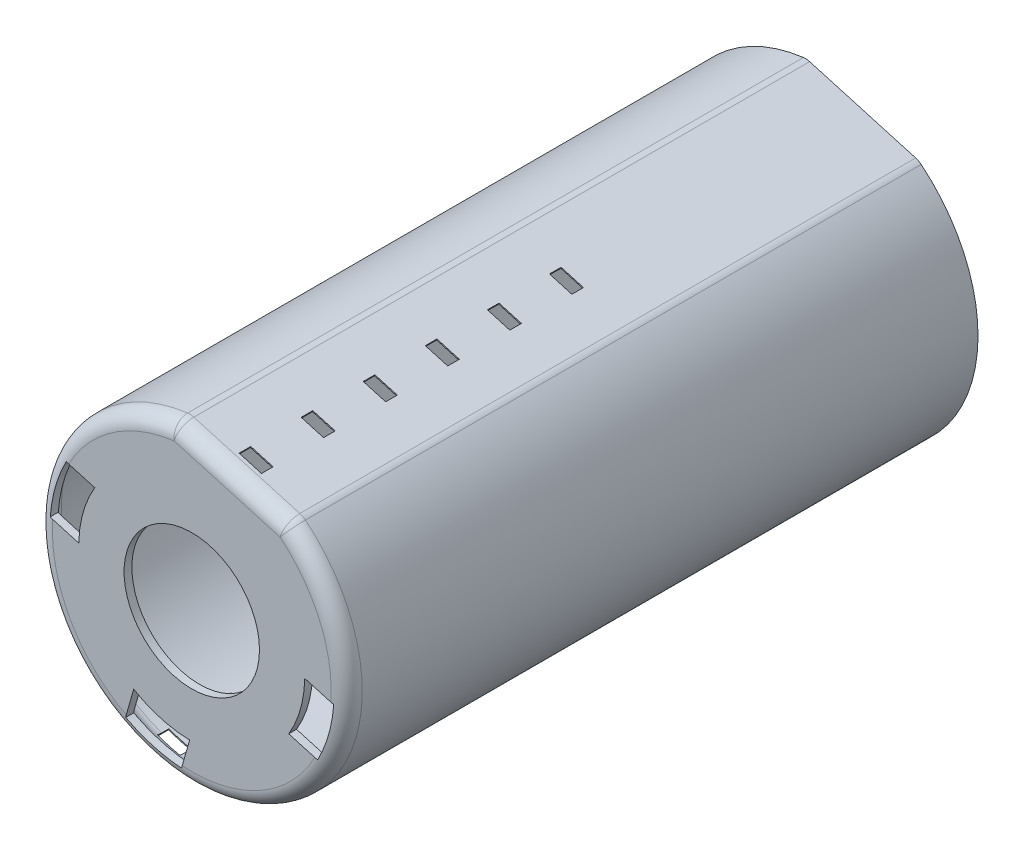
SolidWorks part; units mm, degrees
ref_plane "Front Plane" through (0, 0, 0) normal (0, 0, 1) x (1, 0, 0)
ref_plane "Top Plane" through (0, 0, 0) normal (0, 1, 0) x (1, 0, 0)
ref_plane "Right Plane" through (0, 0, 0) normal (1, 0, 0) x (0, 0, -1)
sketch "Sketch1" plane through (0, 0, 0) normal (0, 0, 1) x (1, 0, 0)
  circle A0 centre (0, 0) radius 174.5
  circle A1 centre (0, 0) radius 399.3
  dimension "D1" = 349
  dimension "D2" = 798.6
extrude "Extrude1" add sketch "Sketch1" along normal blind 20
sketch "Sketch3" plane through (0, 0, 20) normal (0, 0, 1) x (1, 0, 0)
  line L0 (-42.3331, 397.0496) -> (246.3048, 314.284)
  line L1 (101.9858, 355.6668) -> (0, 0) construction
  line L2 (0, 0) -> (0, 399.3) construction
  circle A0 centre (0, 0) radius 399.3 construction
  arc A1 (-42.3331, 397.0496) -> (246.3048, 314.284) centre (0, 0) cw
  dimension "D1" = 16
  dimension "D2" = 370
extrude "Cut-Extrude1" cut sketch "Sketch3" against normal through all
sketch "Sketch4" plane through (0, 0, 0) normal (0, 0, -1) x (-1, 0, 0)
  line L1 (42.3331, 397.0496) -> (-246.3048, 314.284) construction
  line L2 (42.5961, 394.0041) -> (-244.9139, 311.5619)
  line L3 (42.5961, 394.0041) -> (-244.9139, 311.5619)
  line L4 (42.3331, 397.0496) -> (-246.3048, 314.284)
  arc A1 (-246.3048, 314.284) -> (42.3331, 397.0496) centre (0, 0) ccw construction
  arc A2 (-244.9139, 311.5619) -> (42.5961, 394.0041) centre (0, 0) ccw
  arc A3 (-244.9139, 311.5619) -> (42.5961, 394.0041) centre (0, 0) ccw
  arc A4 (-246.3048, 314.284) -> (42.3331, 397.0496) centre (0, 0) ccw
  dimension "D1" = 3
extrude "Extrude2" add sketch "Sketch4" along normal blind 1607.2
sketch "Sketch5" plane through (0, 0, 20) normal (0, 0, 1) x (1, 0, 0)
  line L0 (0, -399.3) -> (0, 0) construction
  line L1 (0, 0) -> (-100.966, -352.1102) construction
  line L2 (-170.9216, -323.9776) -> (-149.6809, -249.9026)
  line L3 (-26.7323, -365.3232) -> (-5.4916, -291.2482)
  arc A0 (-42.3331, 397.0496) -> (246.3048, 314.284) centre (0, 0) ccw construction
  arc A1 (-170.9216, -323.9776) -> (-26.7323, -365.3232) centre (0, 0) ccw
  arc A2 (-149.6809, -249.9026) -> (-5.4916, -291.2482) centre (0, 0) ccw
  dimension "D2" = 75
  dimension "D3" = 366.3
  dimension "D1" = 16
  dimension "D4" = 150
extrude "Cut-Extrude2" cut sketch "Sketch5" against normal blind 50
pattern_circular "CirPattern1" count 4 over 360 about axis through (0, 0, 0) along (0, 0, 1) of "Cut-Extrude2"
sketch "Sketch6" plane through (101.9858, 355.6668, 0) normal (0.2756, 0.9613, 0) x (0.9613, -0.2756, 0)
  line L0 (-30, 43.85) -> (30, 43.85) construction
  line L1 (-30, 28.85) -> (30, 28.85)
  line L2 (-30, 28.85) -> (-30, 58.85)
  line L3 (-30, 58.85) -> (30, 58.85)
  line L4 (30, 28.85) -> (30, 58.85)
  line L7 (-150.1349, -20) -> (150.1349, -20) construction
  line L8 (0, -20) -> (0, 1607.2) construction
  dimension "D1" = 63.85
  dimension "D2" = 30
  dimension "D3" = 60
  dimension "D4" = 30
extrude "Cut-Extrude3" cut sketch "Sketch6" against normal through all
pattern_linear "LPattern1" count 6 spacing 160 along (0, 0, -1) of "Cut-Extrude3"
fillet "Fillet2" radius 40 4 edges at (-42.3331, 397.0496, -793.6) (246.3048, 314.284, -793.6) (-42.5961, 394.0041, -803.6) (244.9139, 311.5619, -803.6)
fillet "Fillet1" radius 40 8 edges at (-109.2351, -380.948, 0) (101.1589, 352.783, 0) (101.9858, 355.6668, 20) (-110.062, -383.8318, 20) (-42.6145, 396.2731, 20) (246.1319, 313.4764, 20) (244.7398, 310.7474, 0) (-42.8801, 393.2211, 0)
